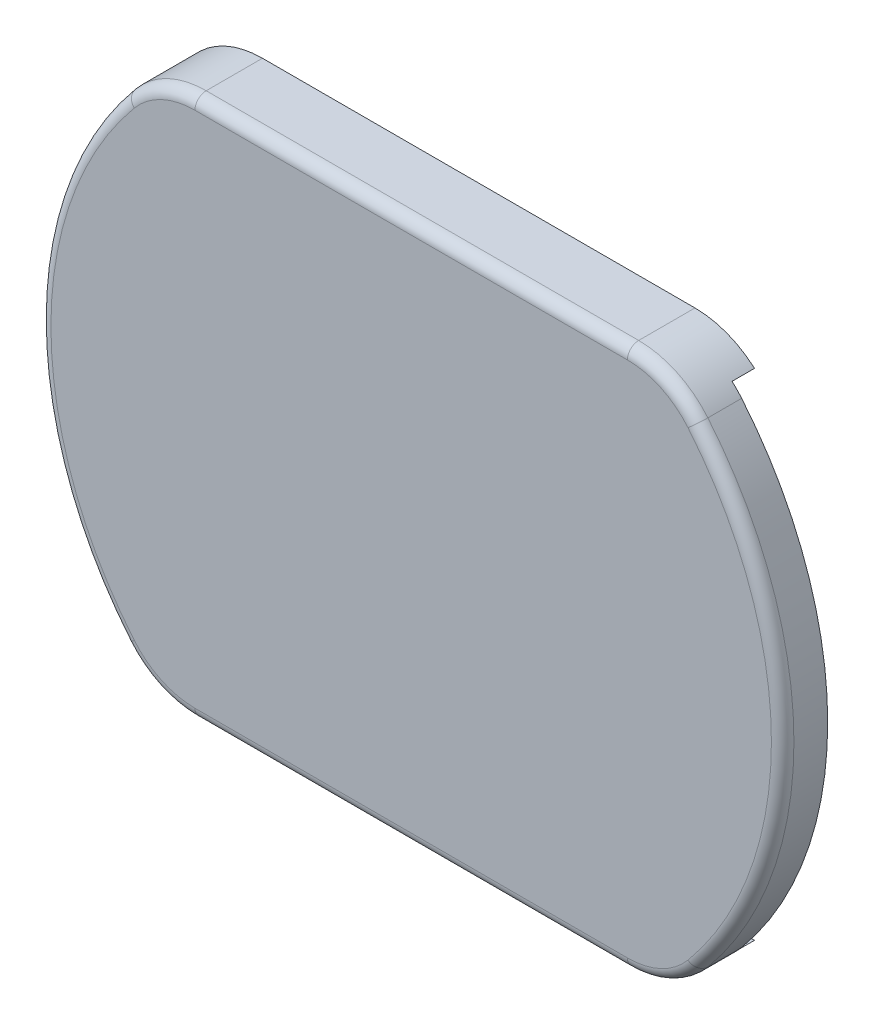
SolidWorks part; units mm, degrees
ref_plane "Front Plane" through (0, 0, 0) normal (0, 0, 1) x (1, 0, 0)
ref_plane "Top Plane" through (0, 0, 0) normal (0, 1, 0) x (1, 0, 0)
ref_plane "Right Plane" through (0, 0, 0) normal (1, 0, 0) x (0, 0, -1)
sketch "Sketch1" plane through (0, 0, 0) normal (0, 0, 1) x (1, 0, 0)
  line L2 (-9.6047, -12) -> (9.6047, -12) construction
  line L3 (7.7375, 12) -> (-7.7375, 12) construction
  line L4 (-9.6047, -12) -> (9.6047, -12)
  line L5 (9.6047, 12) -> (-9.6047, 12)
  arc A6 (-12.6782, -10.56) -> (-9.6047, -12) centre (-9.6047, -8) ccw construction
  arc A7 (9.6047, -12) -> (12.6782, -10.56) centre (9.6047, -8) ccw construction
  arc A8 (-12.6782, 10.56) -> (-12.6782, -10.56) centre (0, 0) ccw construction
  arc A9 (-9.6047, 12) -> (-12.6782, 10.56) centre (-9.6047, 8) ccw construction
  arc A10 (12.6782, -10.56) -> (12.6782, 10.56) centre (0, 0) ccw construction
  arc A11 (12.6782, 10.56) -> (9.6047, 12) centre (9.6047, 8) ccw construction
  arc A13 (-12.6782, -10.56) -> (-9.6047, -12) centre (-9.6047, -8) ccw
  arc A14 (9.6047, -12) -> (12.6782, -10.56) centre (9.6047, -8) ccw
  arc A15 (-12.6782, 10.56) -> (-12.6782, -10.56) centre (0, 0) ccw
  arc A16 (-9.6047, 12) -> (-12.6782, 10.56) centre (-9.6047, 8) ccw
  arc A17 (12.6782, -10.56) -> (12.6782, 10.56) centre (0, 0) ccw
  arc A18 (12.6782, 10.56) -> (9.6047, 12) centre (9.6047, 8) ccw
extrude "Extrude1" add sketch "Sketch1" along normal blind 3
fillet "Fillet2" radius 0.5 8 edges at (-16.5, 0, 3) (-11.3017, 11.6222, 3) (0, 12, 3) (11.3017, 11.6222, 3) (16.5, 0, 3) (11.3017, -11.6222, 3) (0, -12, 3) (-11.3017, -11.6222, 3)
other "Cavity1"
other "Base_&<1>@Exploded_&/Holder_&<1>@Base_&"
sketch "Sketch2" plane through (0, 0, 0) normal (0, 0, -1) x (-1, 0, 0)
  line L0 (9.366, 10.5) -> (-10.5, 10.5) construction
  line L1 (9.366, -10.5) -> (-10.5, -10.5) construction
  line L2 (9.6047, 10.5) -> (-12.7279, 10.5)
  line L3 (9.6047, -10.5) -> (-12.7279, -10.5)
  arc A6 (-12.6782, 10.56) -> (-12.6782, -10.56) centre (0, 0) ccw construction
  arc A7 (-12.7279, 10.5) -> (-12.7279, -10.5) centre (0, 0) ccw
  arc A9 (9.6047, -10.5) -> (11.5256, -9.6) centre (9.6047, -8) ccw
  arc A10 (11.5256, 9.6) -> (9.6047, 10.5) centre (9.6047, 8) ccw
  arc A11 (11.5256, -9.6) -> (11.5256, 9.6) centre (0, 0) ccw
  arc A12 (9.6047, -10.5) -> (11.5256, -9.6) centre (9.6047, -8) ccw
  arc A13 (11.5256, 9.6) -> (9.6047, 10.5) centre (9.6047, 8) ccw
  arc A14 (11.5256, -9.6) -> (11.5256, 9.6) centre (0, 0) ccw
  dimension "D1" = 1.5
extrude "Cut-Extrude1" cut sketch "Sketch2" against normal up to surface (1 mm away)
